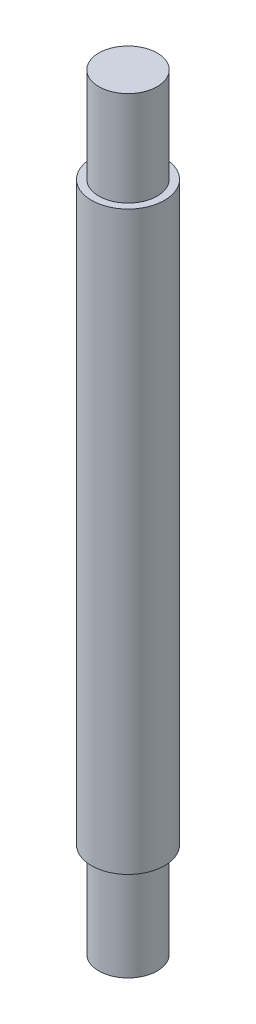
SolidWorks part; units mm, degrees
ref_plane "Front Plane" through (0, 0, 0) normal (0, 0, 1) x (1, 0, 0)
ref_plane "Top Plane" through (0, 0, 0) normal (0, 1, 0) x (1, 0, 0)
ref_plane "Right Plane" through (0, 0, 0) normal (1, 0, 0) x (0, 0, -1)
sketch "Sketch1" plane through (0, 0, 0) normal (0, 0, 1) x (1, 0, 0)
  line L0 (0, 0) -> (0, 16298.1081) construction
  line L1 (0, 52.5) -> (4, 52.5)
  line L2 (4, 52.5) -> (4, 39.5)
  line L3 (4, 39.5) -> (5, 39.5)
  line L4 (5, 39.5) -> (5, -39.5)
  line L5 (0, 0) -> (27.1919, 0) construction
  line L6 (4, -39.5) -> (5, -39.5)
  line L7 (4, -52.5) -> (4, -39.5)
  line L8 (0, -52.5) -> (4, -52.5)
  line L9 (0, 52.5) -> (0, -52.5)
  point P11 (5, 0)
  dimension "D1" = 4
  dimension "D2" = 13
  dimension "D3" = 39.5
  dimension "D4" = 1
revolve "Revolve1" add sketch "Sketch1" angle 360 about L0
